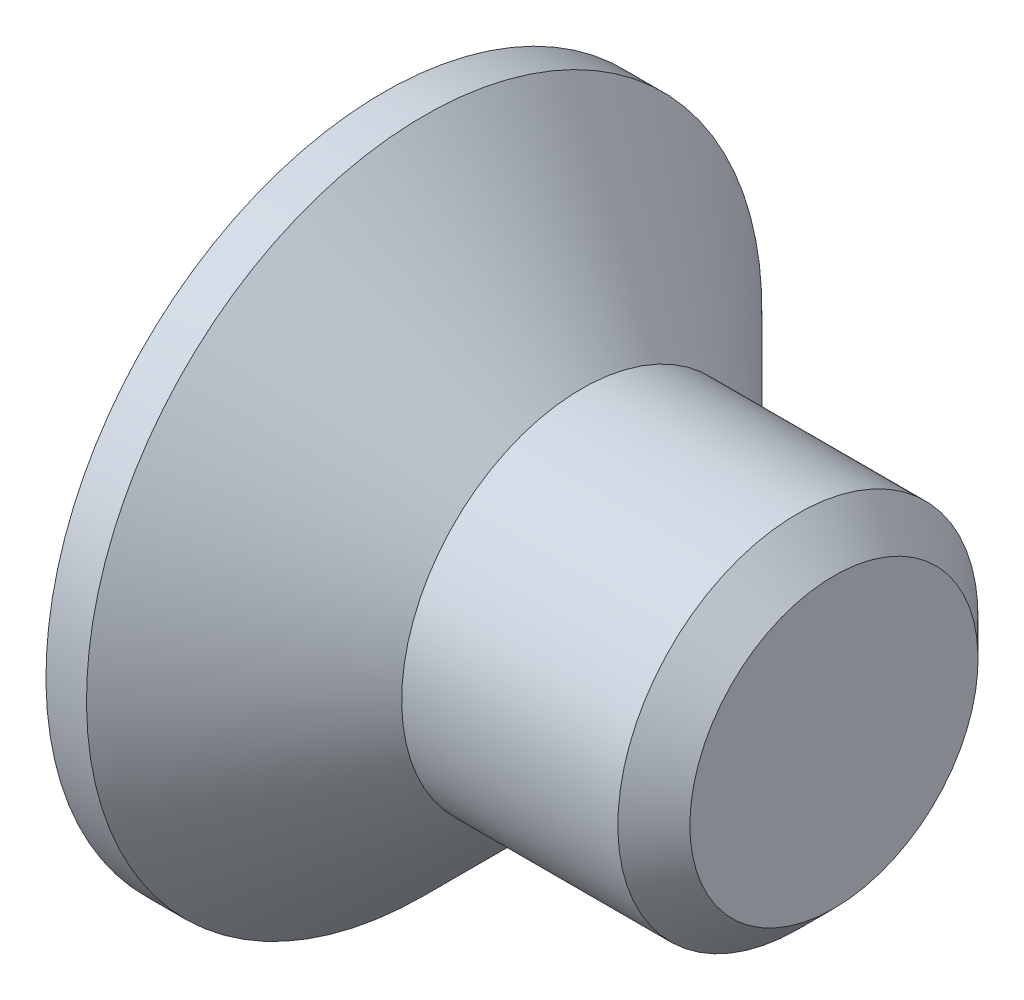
SolidWorks part; units mm, degrees
ref_plane "Front Plane" through (0, 0, 0) normal (0, 0, 1) x (1, 0, 0)
ref_plane "Top Plane" through (0, 0, 0) normal (0, 1, 0) x (1, 0, 0)
ref_plane "Right Plane" through (0, 0, 0) normal (1, 0, 0) x (0, 0, -1)
sketch "Sketch1" plane through (0, 0, 0) normal (0, 0, 1) x (1, 0, 0)
  line L1 (-2.2, 3.75) -> (-2.2, 0)
  line L2 (-2.2, 0) -> (2.8, 0)
  line L3 (2.8, 0) -> (2.8, 2)
  line L4 (2.8, 2) -> (0, 2)
  line L5 (-2.2, 3.75) -> (-1.75, 3.75)
  line L6 (-1.75, 3.75) -> (0, 2)
  dimension "D1" = 2
  dimension "D2" = 45
  dimension "D3" = 2.2
  dimension "D4" = 5
  dimension "D5" = 3.75
revolve "Revolve1" add sketch "Sketch1" angle 360 about L2
chamfer "Chamfer1" distance 0.4 angle 45 1 edges at (2.8, -2, 0)
sketch "Sketch2" plane through (-2.2, 0, 0) normal (-1, 0, 0) x (0, 0, 1)
  line L0 (-0.55, 2.2) -> (0.55, 2.2)
  line L1 (0.55, 2.2) -> (0.55, 0.55)
  line L2 (0.55, 0.55) -> (2.2, 0.55)
  line L3 (2.2, 0.55) -> (2.2, -0.55)
  line L4 (2.2, -0.55) -> (0.55, -0.55)
  line L5 (0.55, -0.55) -> (0.55, -2.2)
  line L6 (0.55, -2.2) -> (-0.55, -2.2)
  line L7 (-0.55, -2.2) -> (-0.55, -0.55)
  line L8 (-0.55, -0.55) -> (-2.2, -0.55)
  line L9 (-2.2, -0.55) -> (-2.2, 0.55)
  line L10 (-2.2, 0.55) -> (-0.55, 0.55)
  line L11 (-0.55, 0.55) -> (-0.55, 2.2)
  point P2 (0, 2.2)
  point P14 (0, -2.2)
  point P15 (2.2, 0)
  point P16 (-2.2, 0)
  point P17 (0.2443, 1.0495)
  point P18 (1.175, 0.2864)
  dimension "D1" = 4.4
  dimension "D2" = 1.1
extrude "Cut-Extrude1" cut sketch "Sketch2" against normal blind 1.9
